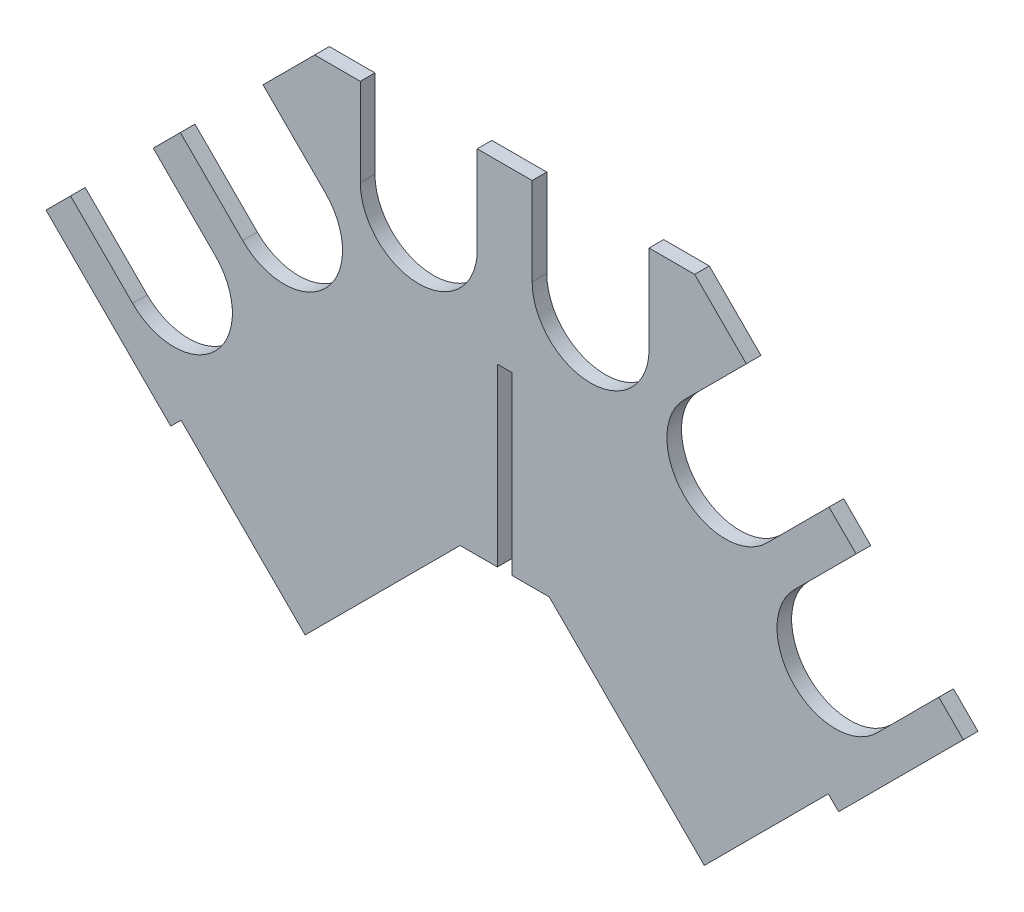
SolidWorks part; units mm, degrees
ref_plane "Front Plane" through (0, 0, 0) normal (0, 0, 1) x (1, 0, 0)
ref_plane "Top Plane" through (0, 0, 0) normal (0, 1, 0) x (1, 0, 0)
ref_plane "Right Plane" through (0, 0, 0) normal (1, 0, 0) x (0, 0, -1)
sketch "Sketch1" plane through (0, 0, 0) normal (0, 0, 1) x (1, 0, 0)
  line L0 (-6.35, 478.7708) -> (6.35, 478.7708) construction
  line L1 (-6.35, 478.7708) -> (6.35, 478.7708)
  line L2 (-6.35, 785.3759) -> (-6.35, 101.6) construction
  line L3 (6.35, 785.3759) -> (6.35, 101.6) construction
  line L4 (-6.35, 478.7708) -> (-6.35, 326.1064)
  line L5 (6.35, 478.7708) -> (6.35, 326.1064)
  line L6 (165.1, 632.0733) -> (398.5867, 398.5867) construction
  line L7 (-165.1, 632.0733) -> (165.1, 632.0733) construction
  line L8 (-165.1, 632.0733) -> (-398.5867, 398.5867) construction
  line L9 (165.1, 632.0733) -> (398.5867, 398.5867)
  line L10 (-165.1, 632.0733) -> (165.1, 632.0733)
  line L11 (-165.1, 632.0733) -> (-398.5867, 398.5867)
  line L12 (6.35, 326.1064) -> (38.7382, 326.1064)
  line L13 (-498.0077, 515.9682) -> (-14.5051, 32.4656) construction
  line L14 (-290.1854, 290.1854) -> (-398.5867, 398.5867) construction
  line L15 (-290.1854, 290.1854) -> (-281.2051, 299.1656) construction
  line L16 (281.2051, 299.1656) -> (290.1854, 290.1854) construction
  line L17 (290.1854, 290.1854) -> (398.5867, 398.5867) construction
  line L18 (173.2551, 191.2156) -> (281.2051, 299.1656) construction
  line L19 (-281.2051, 299.1656) -> (-173.442, 191.4026)
  line L20 (-290.1854, 290.1854) -> (-398.5867, 398.5867)
  line L21 (-290.1854, 290.1854) -> (-281.2051, 299.1656)
  line L22 (281.2051, 299.1656) -> (290.1854, 290.1854)
  line L23 (290.1854, 290.1854) -> (398.5867, 398.5867)
  line L24 (-182.4223, 182.4223) -> (-38.7382, 326.1064) construction
  line L25 (-38.7382, 326.1064) -> (38.7382, 326.1064) construction
  line L26 (182.4223, 182.4223) -> (38.7382, 326.1064) construction
  line L27 (-173.442, 191.4026) -> (-38.7382, 326.1064)
  line L28 (-38.7382, 326.1064) -> (-6.35, 326.1064)
  line L29 (173.442, 191.4026) -> (38.7382, 326.1064)
  line L30 (173.442, 191.4026) -> (281.2051, 299.1656)
  circle A0 centre (287.4229, 401.9873) radius 50.8 construction
  circle A1 centre (-287.4229, 401.9873) radius 50.8 construction
  circle A2 centre (-191.7217, 497.0504) radius 50.8 construction
  circle A3 centre (191.7217, 497.0504) radius 50.8 construction
  circle A4 centre (74.6592, 555.8733) radius 50.8 construction
  circle A5 centre (-74.6592, 555.8733) radius 50.8 construction
  circle A6 centre (287.4229, 401.9873) radius 50.8
  circle A7 centre (-287.4229, 401.9873) radius 50.8
  circle A8 centre (-191.7217, 497.0504) radius 50.8
  circle A9 centre (191.7217, 497.0504) radius 50.8
  circle A10 centre (74.6592, 555.8733) radius 50.8
  circle A11 centre (-74.6592, 555.8733) radius 50.8
extrude "Extrude1" add sketch "Sketch1" along normal blind 12.7
sketch "Sketch2" plane through (0, 0, 12.7) normal (0, 0, 1) x (1, 0, 0)
  line L0 (251.5019, 437.9083) -> (305.3835, 491.7899)
  line L1 (227.6427, 461.1293) -> (281.8433, 515.33)
  line L2 (323.344, 366.0663) -> (377.2255, 419.9478)
  line L3 (210.0013, 587.172) -> (155.8006, 532.9714)
  line L4 (125.4592, 632.0733) -> (125.4592, 555.8733)
  line L5 (23.8592, 632.0733) -> (23.8592, 555.8733)
  line L6 (-23.8592, 632.0733) -> (-23.8592, 555.8733)
  line L7 (-125.4592, 632.0733) -> (-125.4592, 555.8733)
  line L8 (-210.0013, 587.172) -> (-155.8006, 532.9714)
  line L9 (-305.3835, 491.7899) -> (-251.5019, 437.9083)
  line L10 (-281.8433, 515.33) -> (-227.6427, 461.1293)
  line L11 (-377.2255, 419.9478) -> (-323.344, 366.0663)
  line L12 (-165.1, 632.0733) -> (-398.5867, 398.5867) construction
  line L13 (165.1, 632.0733) -> (-165.1, 632.0733) construction
  line L14 (398.5867, 398.5867) -> (165.1, 632.0733) construction
  line L15 (-210.0013, 587.172) -> (-281.8433, 515.33)
  line L16 (125.4592, 632.0733) -> (23.8592, 632.0733)
  line L17 (377.2255, 419.9478) -> (305.3835, 491.7899)
  line L18 (-305.3835, 491.7899) -> (-377.2255, 419.9478)
  line L19 (-23.8592, 632.0733) -> (-125.4592, 632.0733)
  line L20 (281.8433, 515.33) -> (210.0013, 587.172)
  circle A0 centre (74.6592, 555.8733) radius 50.8 construction
  circle A1 centre (-74.6592, 555.8733) radius 50.8 construction
  circle A2 centre (287.4229, 401.9873) radius 50.8 construction
  circle A3 centre (191.7217, 497.0504) radius 50.8 construction
  circle A4 centre (-191.7217, 497.0504) radius 50.8 construction
  circle A5 centre (-287.4229, 401.9873) radius 50.8 construction
  arc A6 (323.344, 366.0663) -> (251.5019, 437.9083) centre (287.4229, 401.9873) ccw
  arc A7 (227.6427, 461.1293) -> (155.8006, 532.9714) centre (191.7217, 497.0504) ccw
  arc A8 (125.4592, 555.8733) -> (23.8592, 555.8733) centre (74.6592, 555.8733) ccw
  arc A9 (-23.8592, 555.8733) -> (-125.4592, 555.8733) centre (-74.6592, 555.8733) ccw
  arc A10 (-155.8006, 532.9714) -> (-227.6427, 461.1293) centre (-191.7217, 497.0504) ccw
  arc A11 (-251.5019, 437.9083) -> (-323.344, 366.0663) centre (-287.4229, 401.9873) ccw
extrude "Cut-Extrude1" cut sketch "Sketch2" against normal up to next
